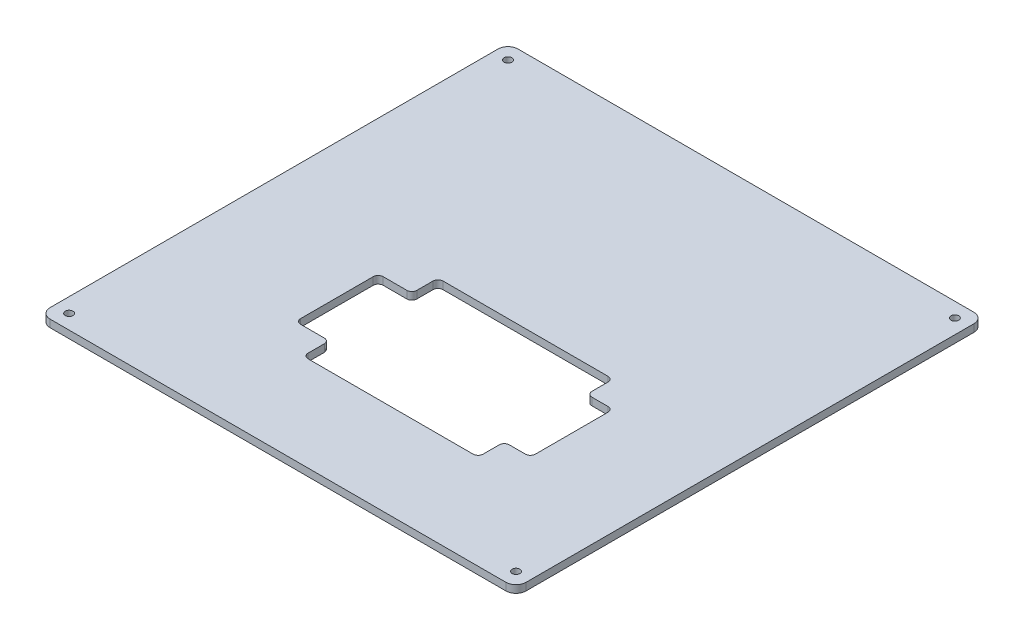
SolidWorks part; units mm, degrees
ref_plane "Front Plane" through (0, 0, 0) normal (0, 0, 1) x (1, 0, 0)
ref_plane "Top Plane" through (0, 0, 0) normal (0, 1, 0) x (1, 0, 0)
ref_plane "Right Plane" through (0, 0, 0) normal (1, 0, 0) x (0, 0, -1)
sketch "Sketch1" plane through (0, 0, 0) normal (0, 1, 0) x (1, 0, 0)
  line L8 (-92.54, -93.49) -> (97.64, -93.49)
  line L9 (-92.54, -93.49) -> (-92.54, 93.49)
  line L10 (-92.54, 93.49) -> (97.64, 93.49)
  line L11 (97.64, -93.49) -> (97.64, 93.49)
  dimension "D1" = 186.98
  dimension "D2" = 190.18
  dimension "D3" = 97.64
  dimension "D4" = 93.49
extrude "Boss-Extrude1" add sketch "Sketch1" along normal blind 3
sketch "Sketch2" plane through (0, 0, 0) normal (0, -1, 0) x (1, 0, 0)
  line L1 (55.15, 1.79) -> (-35.68, 1.79)
  line L2 (55.15, 1.79) -> (55.15, 55.69)
  line L3 (55.15, 55.69) -> (-35.68, 55.69)
  line L4 (-35.68, 1.79) -> (-35.68, 55.69)
  dimension "D1" = 55.15
  dimension "D2" = 90.83
  dimension "D3" = 55.69
  dimension "D4" = 53.9
extrude "Cut-Extrude1" cut sketch "Sketch2" against normal up to next
sketch "Sketch3" plane through (0, 0, 0) normal (0, -1, 0) x (1, 0, 0)
  line L1 (-35.68, 55.69) -> (-25.23, 55.69)
  line L2 (-35.68, 55.69) -> (-35.68, 45.24)
  line L3 (-35.68, 45.24) -> (-25.23, 45.24)
  line L4 (-25.23, 55.69) -> (-25.23, 45.24)
  line L5 (-35.68, 1.79) -> (-25.23, 1.79)
  line L6 (-35.68, 1.79) -> (-35.68, 12.24)
  line L7 (-35.68, 12.24) -> (-25.23, 12.24)
  line L8 (-25.23, 1.79) -> (-25.23, 12.24)
  line L9 (55.15, 55.69) -> (44.7, 55.69)
  line L10 (55.15, 55.69) -> (55.15, 45.24)
  line L11 (55.15, 45.24) -> (44.7, 45.24)
  line L12 (44.7, 55.69) -> (44.7, 45.24)
  line L13 (55.15, 1.79) -> (44.7, 1.79)
  line L14 (55.15, 1.79) -> (55.15, 12.24)
  line L15 (55.15, 12.24) -> (44.7, 12.24)
  line L16 (44.7, 1.79) -> (44.7, 12.24)
  dimension "D1" = 10.45
extrude "Boss-Extrude2" add sketch "Sketch3" against normal blind 3
sketch "Sketch4" plane through (0, 0, 0) normal (0, -1, 0) x (1, 0, 0)
  line L0 (-35.68, 45.24) -> (-25.23, 45.24) construction
  line L1 (-35.68, 12.24) -> (-38.68, 12.24)
  line L2 (-35.68, 12.24) -> (-35.68, 45.24)
  line L3 (-35.68, 45.24) -> (-38.68, 45.24)
  line L4 (-38.68, 12.24) -> (-38.68, 45.24)
  dimension "D1" = 3
extrude "Cut-Extrude2" cut sketch "Sketch4" against normal up to next
sketch "Sketch5" plane through (0, 0, 0) normal (0, -1, 0) x (1, 0, 0)
  line L0 (2.55, 93.49) -> (2.55, -93.49) construction
  line L1 (-92.54, 93.49) -> (97.64, 93.49) construction
  line L2 (97.64, -93.49) -> (-92.54, -93.49) construction
  line L3 (97.64, 0) -> (-92.54, 0) construction
  line L4 (97.64, 93.49) -> (97.64, -93.49) construction
  line L5 (-92.54, -93.49) -> (-92.54, 93.49) construction
  circle A0 centre (-86.74, 87.69) radius 1.55
  circle A4 centre (91.84, 87.69) radius 1.55
  circle A5 centre (-86.74, -87.69) radius 1.55
  circle A6 centre (91.84, -87.69) radius 1.55
  dimension "D1" = 3.1
  dimension "D2" = 5.8
  dimension "D3" = 5.8
extrude "Cut-Extrude3" cut sketch "Sketch5" against normal up to next
fillet "Fillet2" radius 4 4 edges at (-92.54, 1.5, 93.49) (97.64, 1.5, 93.49) (97.64, 1.5, -93.49) (-92.54, 1.5, -93.49)
fillet "Fillet3" radius 2 12 edges at (-25.23, 1.5, 1.79) (-25.23, 1.5, 12.24) (-38.68, 1.5, 12.24) (-38.68, 1.5, 45.24) (-25.23, 1.5, 45.24) (-25.23, 1.5, 55.69) (44.7, 1.5, 1.79) (44.7, 1.5, 12.24) (55.15, 1.5, 12.24) (55.15, 1.5, 45.24) (44.7, 1.5, 45.24) (44.7, 1.5, 55.69)
